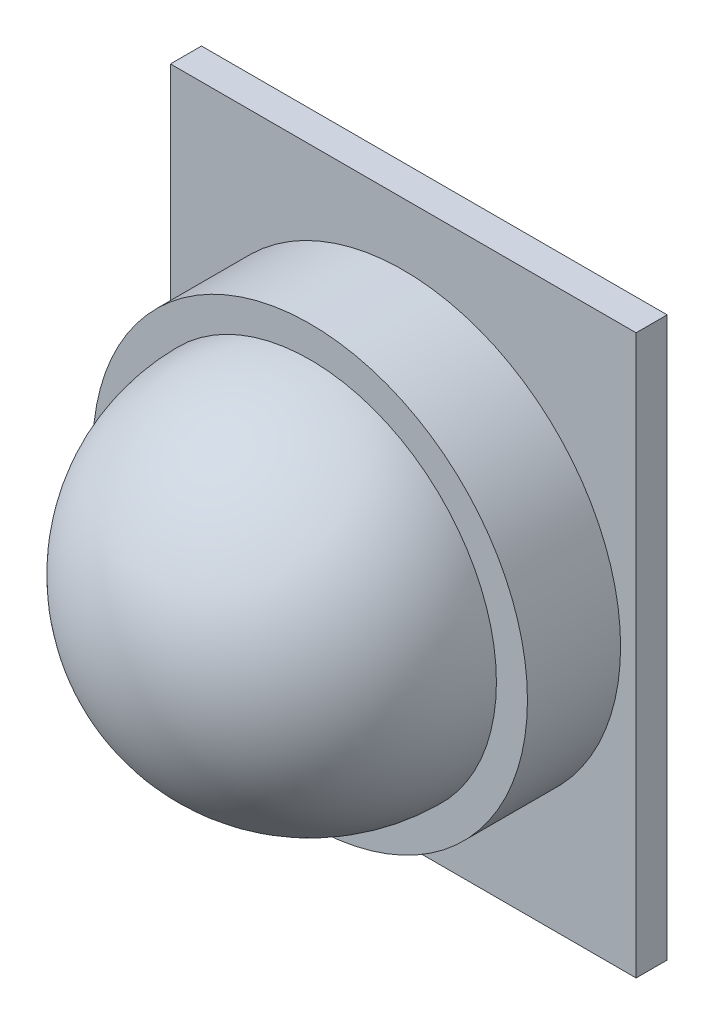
SolidWorks part; units mm, degrees
ref_plane "Plan de face" through (0, 0, 0) normal (0, 0, 1) x (1, 0, 0)
ref_plane "Plan de dessus" through (0, 0, 0) normal (0, 1, 0) x (1, 0, 0)
ref_plane "Plan de droite" through (0, 0, 0) normal (1, 0, 0) x (0, 0, -1)
sketch "Esquisse1" plane through (0, 0, 0) normal (0, 0, 1) x (1, 0, 0)
  line L1 (-3.75, 4.5) -> (3.75, 4.5)
  line L2 (-3.75, 4.5) -> (-3.75, -4.5)
  line L3 (-3.75, -4.5) -> (3.75, -4.5)
  line L4 (3.75, 4.5) -> (3.75, -4.5)
  dimension "D1" = 9
  dimension "D2" = 7.5
  dimension "D3" = 3.75
  dimension "D4" = 4.5
extrude "Extrusion1" add sketch "Esquisse1" along normal blind 0.5
sketch "Esquisse2" plane through (0, 0, 0.5) normal (0, 0, 1) x (1, 0, 0)
  circle A0 centre (0, 0) radius 3.5
extrude "Extrusion2" add sketch "Esquisse2" along normal blind 1.5
sketch "Esquisse3" plane through (0, 0, 2) normal (0, 0, 1) x (1, 0, 0)
  line L0 (0, 3.8355) -> (0, -4.717) construction
  arc A0 (0, 3.4979) -> (0, -3.4979) centre (0, 0) cw
sketch "Esquisse4" plane through (0, 0, 2) normal (0, 0, 1) x (1, 0, 0)
  line L0 (0, 3.8355) -> (0, -4.717) construction
  line L1 (0, -3) -> (0, 3)
  arc A0 (0, 3) -> (0, -3) centre (0, 0) cw
  dimension "D1" = 3
revolve "Révolution3" add sketch "Esquisse4" angle 180 about L1
